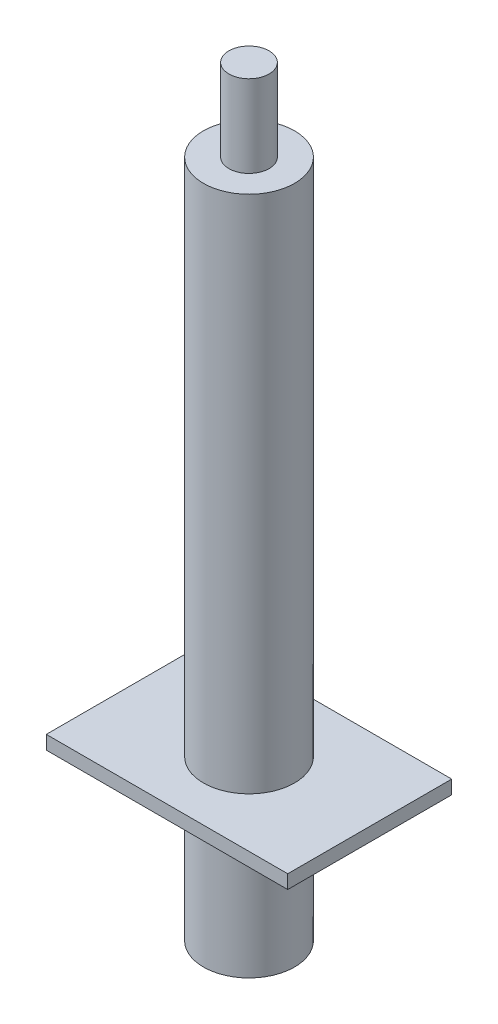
SolidWorks part; units mm, degrees
ref_plane "前视基准面" through (0, 0, 0) normal (0, 0, 1) x (1, 0, 0)
ref_plane "上视基准面" through (0, 0, 0) normal (0, 1, 0) x (1, 0, 0)
ref_plane "右视基准面" through (0, 0, 0) normal (1, 0, 0) x (0, 0, -1)
other "Configuration Table"
sketch "草图1" plane through (0, 0, 0) normal (0, 1, 0) x (1, 0, 0)
  circle A0 centre (0, 0) radius 5
extrude "凸台-拉伸1" add sketch "草图1" along normal blind 57
sketch "草图2" plane through (0, 57, 0) normal (0, 1, 0) x (1, 0, 0)
  circle A0 centre (0, 0) radius 2.2038
extrude "凸台-拉伸3" add sketch "草图2" along normal blind 9
sketch "草图3" plane through (0, 0, 0) normal (0, -1, 0) x (1, 0, 0)
  line L1 (-13.25, -9) -> (13.25, -9)
  line L2 (-13.25, -9) -> (-13.25, 9)
  line L3 (-13.25, 9) -> (13.25, 9)
  line L4 (13.25, -9) -> (13.25, 9)
  line L5 (-13.25, -9) -> (13.25, 9) construction
  line L6 (-13.25, 9) -> (13.25, -9) construction
  point P0 (0, 0)
  dimension "D1" = 26.5
  dimension "D2" = 18
extrude "凸台-拉伸4" add sketch "草图3" along normal blind 1.5
sketch "草图5" plane through (0, -1.5, 0) normal (0, -1, 0) x (1, 0, 0)
  circle A0 centre (0, 0) radius 5
extrude "凸台-拉伸5" add sketch "草图5" along normal blind 16
